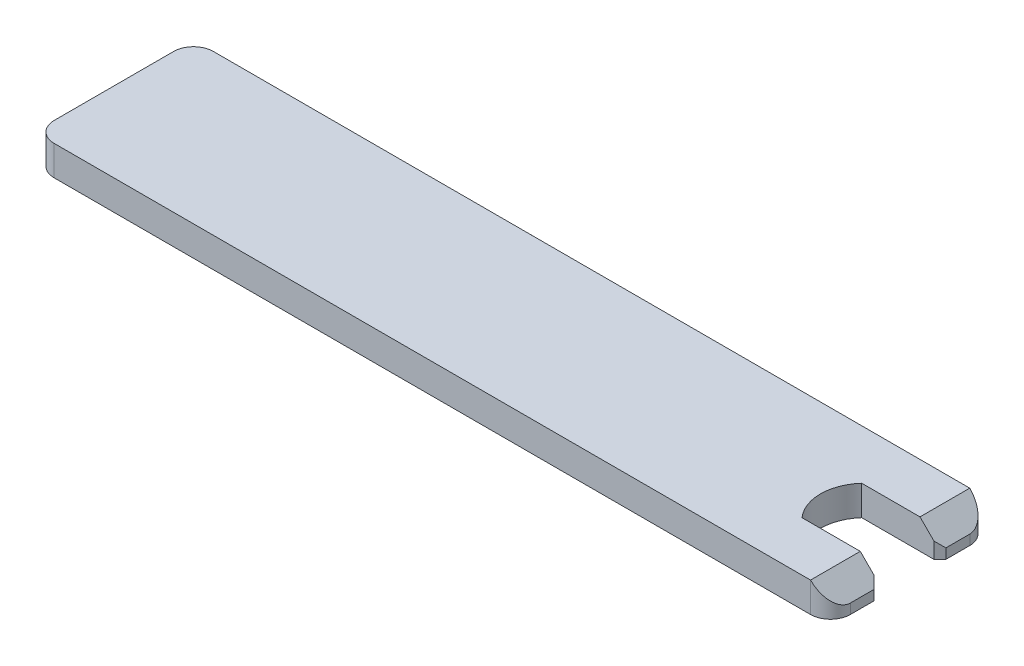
SolidWorks part; units mm, degrees
ref_plane "X_Y" through (0, 0, 0) normal (0, 0, 1) x (1, 0, 0)
ref_plane "Z_X" through (0, 0, 0) normal (0, 1, 0) x (1, 0, 0)
ref_plane "Y_Z" through (0, 0, 0) normal (1, 0, 0) x (0, 0, -1)
sketch "Sketch1" plane through (0, 0, 0) normal (0, 1, 0) x (1, 0, 0)
  line L0 (-1.6771, 1.5) -> (2.25, 1.5)
  line L1 (2.25, 1.5) -> (2.25, 4)
  line L2 (2.25, 4) -> (-37.75, 4)
  line L3 (-37.75, 4) -> (-37.75, -4)
  line L5 (-55, 0) -> (55, 0) construction
  line L6 (2.25, -1.5) -> (2.25, -4)
  line L7 (-1.6771, -1.5) -> (2.25, -1.5)
  line L8 (2.25, -4) -> (-37.75, -4)
  circle A0 centre (0, 0) radius 2.25 construction
  arc A1 (-1.6771, 1.5) -> (-1.6771, -1.5) centre (0, 0) ccw
  dimension "D1" = 3
  dimension "D2" = 4.5
  dimension "D3" = 8
  dimension "D4" = 40
extrude "Boss-Extrude1" add sketch "Sketch1" along normal mid plane 1.5
chamfer "Chamfer2" distance 1 angle 45 2 edges at (2.25, 0.75, -2.75) (2.25, 0.75, 2.75)
fillet "Fillet1" radius 1 4 edges at (2.25, -0.5, -4) (2.25, -0.5, 4) (-37.75, 0, -4) (-37.75, 0, 4)
chamfer "Chamfer1" distance 0.3 angle 45 2 edges at (2.25, -0.5, -1.5) (2.25, -0.5, 1.5)
